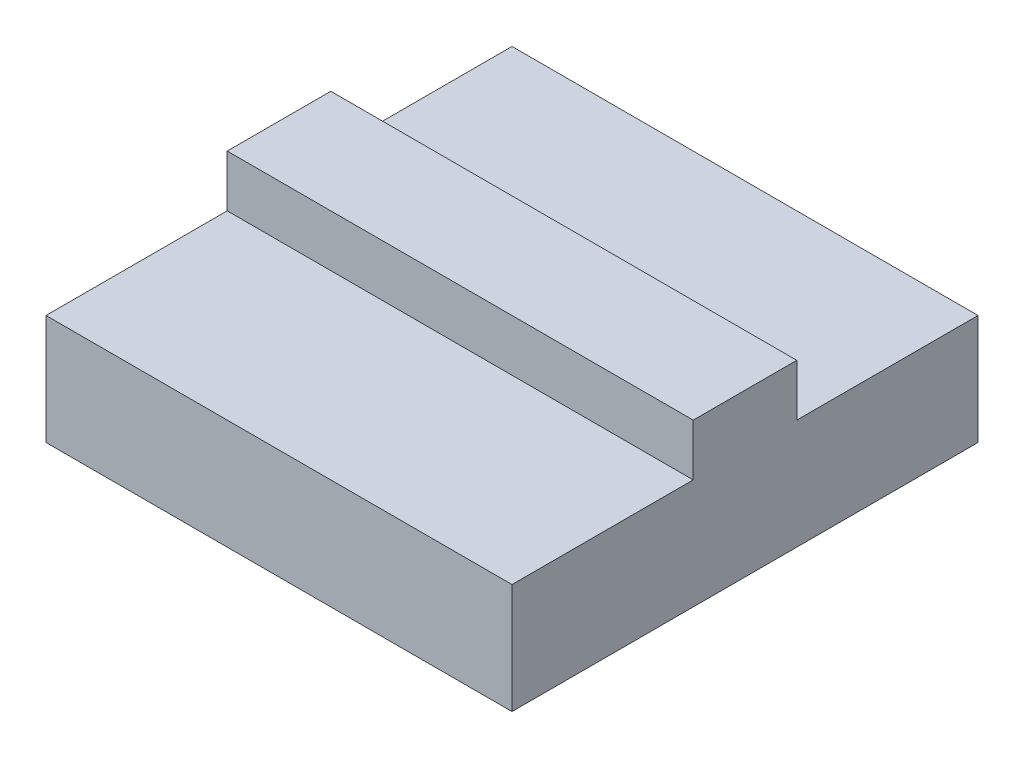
SolidWorks part; units mm, degrees
ref_plane "Front Plane" through (0, 0, 0) normal (0, 0, 1) x (1, 0, 0)
ref_plane "Top Plane" through (0, 0, 0) normal (0, 1, 0) x (1, 0, 0)
ref_plane "Right Plane" through (0, 0, 0) normal (1, 0, 0) x (0, 0, -1)
sketch "Sketch1" plane through (0, 0, 0) normal (0, 1, 0) x (1, 0, 0)
  line L1 (45, 45) -> (-45, 45)
  line L2 (45, 45) -> (45, -45)
  line L3 (45, -45) -> (-45, -45)
  line L4 (-45, 45) -> (-45, -45)
  line L5 (45, 45) -> (-45, -45) construction
  line L6 (45, -45) -> (-45, 45) construction
  point P0 (0, 0)
  dimension "D1" = 90
  dimension "D2" = 90
extrude "Boss-Extrude1" add sketch "Sketch1" along normal blind 21.25
sketch "Sketch2" plane through (45, 0, 0) normal (1, 0, 0) x (0, 0, -1)
  line L0 (-45, 21.25) -> (45, 21.25) construction
  line L1 (-10, 21.25) -> (10, 21.25)
  line L2 (-10, 21.25) -> (-10, 31.25)
  line L3 (-10, 31.25) -> (10, 31.25)
  line L4 (10, 21.25) -> (10, 31.25)
  point P6 (0, 21.25)
  dimension "D1" = 20
  dimension "D2" = 10
extrude "Boss-Extrude2" add sketch "Sketch2" against normal up to surface (90 mm away)
